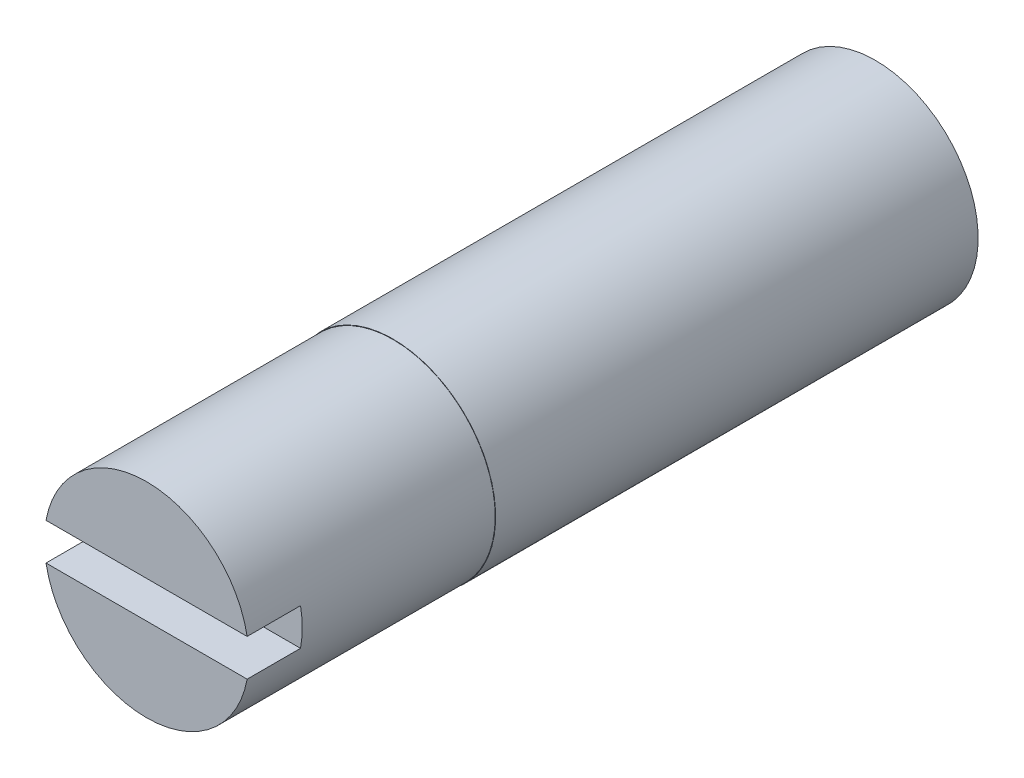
SolidWorks part; units mm, degrees
other "標示1"
sketch "草圖10" plane through (-2.5, -2.5, 3) normal (-0.9436, -0.3126, 0.109) x (0.3106, -0.9499, -0.0352)
ref_plane "前基準面" through (0, 0, 0) normal (0, 0, 1) x (1, 0, 0)
ref_plane "上基準面" through (0, 0, 0) normal (0, 1, 0) x (1, 0, 0)
ref_plane "右基準面" through (0, 0, 0) normal (1, 0, 0) x (0, 0, -1)
sketch "草圖1" plane through (0, 0, 0) normal (0, 0, 1) x (1, 0, 0)
  circle A0 centre (0, 0) radius 2.49
  dimension "D1" = 4.98
extrude "填料-伸長1" add sketch "草圖1" along normal blind 6
sketch "草圖8" plane through (0, 0, 6) normal (0, 0, 1) x (1, 0, 0)
  line L0 (0, 0) -> (2.5, 0)
  line L1 (2.5, -0.45) -> (2.5, 0.45)
  line L6 (0, 2.49) -> (0, -2.49)
  line L7 (2.5, -0.45) -> (-2.5, -0.45)
  line L8 (2.5, 0.45) -> (-2.5, 0.45)
  line L9 (-2.5, -0.45) -> (-2.5, 0.45)
  circle A0 centre (0, 0) radius 2.49 construction
  point P12 (0, -0.45)
  point P14 (0, 0.45)
  dimension "D1" = 0.45
  dimension "D2" = 2.5
extrude "除料-伸長2" cut sketch "草圖8" against normal blind 1.3 contours L1 L8 L6 L0 | L7 L1 L0 L6 | L9 L7 L6 L8
sketch "草圖9" plane through (0, 0, 0) normal (0, 0, -1) x (-1, 0, 0)
  circle A0 centre (0, 0) radius 2.5
  dimension "D1" = 5
extrude "填料-伸長2" add sketch "草圖9" along normal blind 11.75
